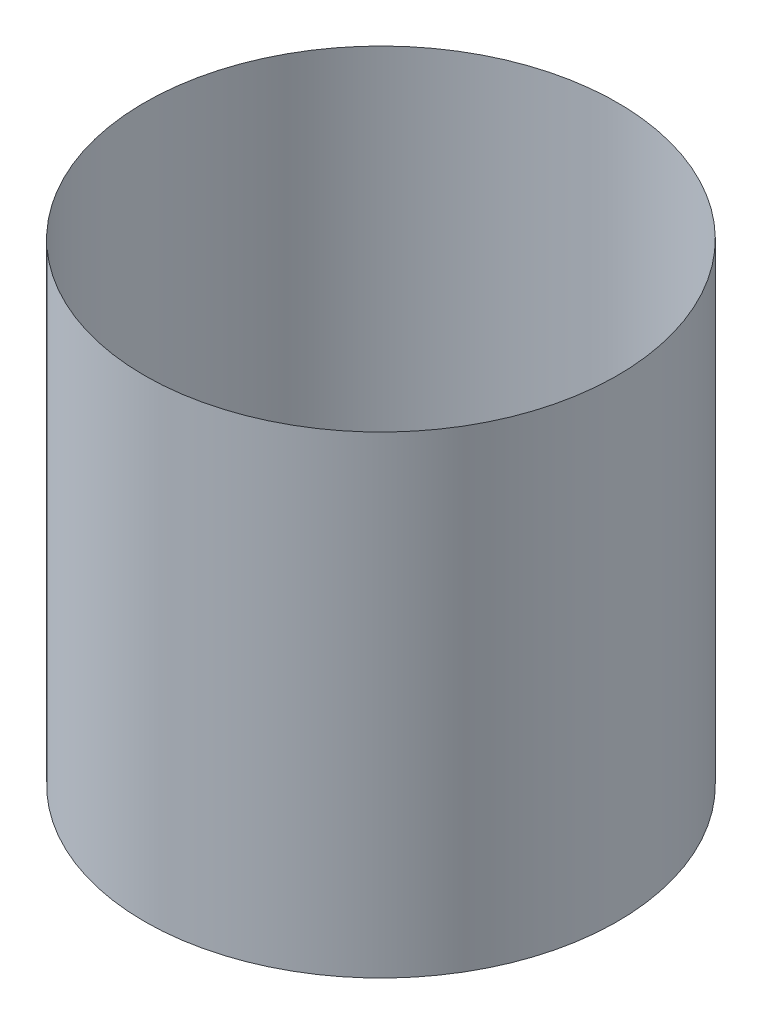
SolidWorks part; units mm, degrees
ref_plane "Front Plane" through (0, 0, 0) normal (0, 0, 1) x (1, 0, 0)
ref_plane "Top Plane" through (0, 0, 0) normal (0, 1, 0) x (1, 0, 0)
ref_plane "Right Plane" through (0, 0, 0) normal (1, 0, 0) x (0, 0, -1)
sketch "Sketch1" plane through (0, 0, 0) normal (0, 1, 0) x (1, 0, 0)
  circle A0 centre (0, 0) radius 12.5
  dimension "D1" = 25
extrude "Boss-Extrude1" add sketch "Sketch1" along normal blind 25
other "DeleteFace1"
